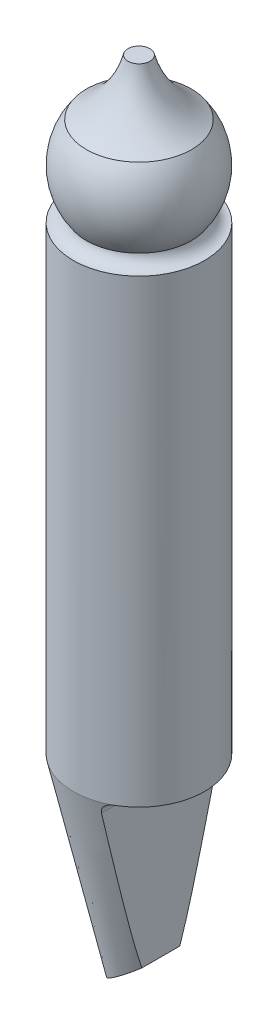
SolidWorks part; units mm, degrees
ref_plane "Front Plane" through (0, 0, 0) normal (0, 0, 1) x (1, 0, 0)
ref_plane "Top Plane" through (0, 0, 0) normal (0, 1, 0) x (1, 0, 0)
ref_plane "Right Plane" through (0, 0, 0) normal (1, 0, 0) x (0, 0, -1)
sketch "Sketch1" plane through (0, 0, 0) normal (0, 0, 1) x (1, 0, 0)
  line L0 (0, 30) -> (0, 0)
  line L1 (3, 30) -> (3, 9)
  line L2 (2.9773, 30) -> (3, 30)
  line L3 (0, 30) -> (3, 30) construction
  line L4 (0, 9) -> (3, 9)
  line L5 (3, 30) -> (3, 0) construction
  line L6 (3, 9) -> (1, 0)
  line L7 (1, 0) -> (0, 0)
  line L8 (0, 0) -> (-0.0162, -0.0215)
  line L15 (0, 30) -> (0, 36.6288)
  line L16 (0, 36.6288) -> (0.5, 36.6288)
  arc A1 (2.4, 30.4839) -> (2.4, 34.0839) centre (0, 32.2839) ccw
  arc A2 (0.5, 36.6288) -> (2.4, 34.0839) centre (4.3919, 37.5526) ccw
  arc A3 (2.4, 30.4839) -> (3, 30) centre (2.9887, 30.5999) ccw
  dimension "D8" = 4
  dimension "D9" = 0.6
  dimension "D1" = 30
  dimension "D4" = 1
  dimension "D7" = 0.5
  dimension "D2" = 3
  dimension "D3" = 21
revolve "Revolve1" add sketch "Sketch1" angle 360 about L0
sketch "Sketch3" plane through (0, 0, 0) normal (0, 0, 1) x (1, 0, 0)
  line L0 (0, 0) -> (0, 0.7265)
  line L1 (1, 1.4531) -> (1, 9)
  line L2 (-1, 0) -> (1, 1.4531)
  line L3 (-1, 0) -> (1, 0)
  line L4 (1, 0) -> (1, 9.2467) construction
  line L5 (1, 0) -> (1, 1.4531)
  line L6 (3, 9) -> (-3, 9) construction
  line L7 (3, 9) -> (1, 9)
  line L8 (1, 0) -> (3, 9) construction
  line L9 (1, 0) -> (3, 9)
  line L12 (0, 0) -> (0, 9.2467) construction
  dimension "D2" = 126
  dimension "D1" = 1
extrude "Cut-Extrude1" cut sketch "Sketch3" against normal through all both and the other way through all contours L5 L9 L7 L1 | L3 L5 L2 L0 | L2 L3 L0
fillet "Fillet1" radius 0.5 1 edges at (1, 9, 0)
